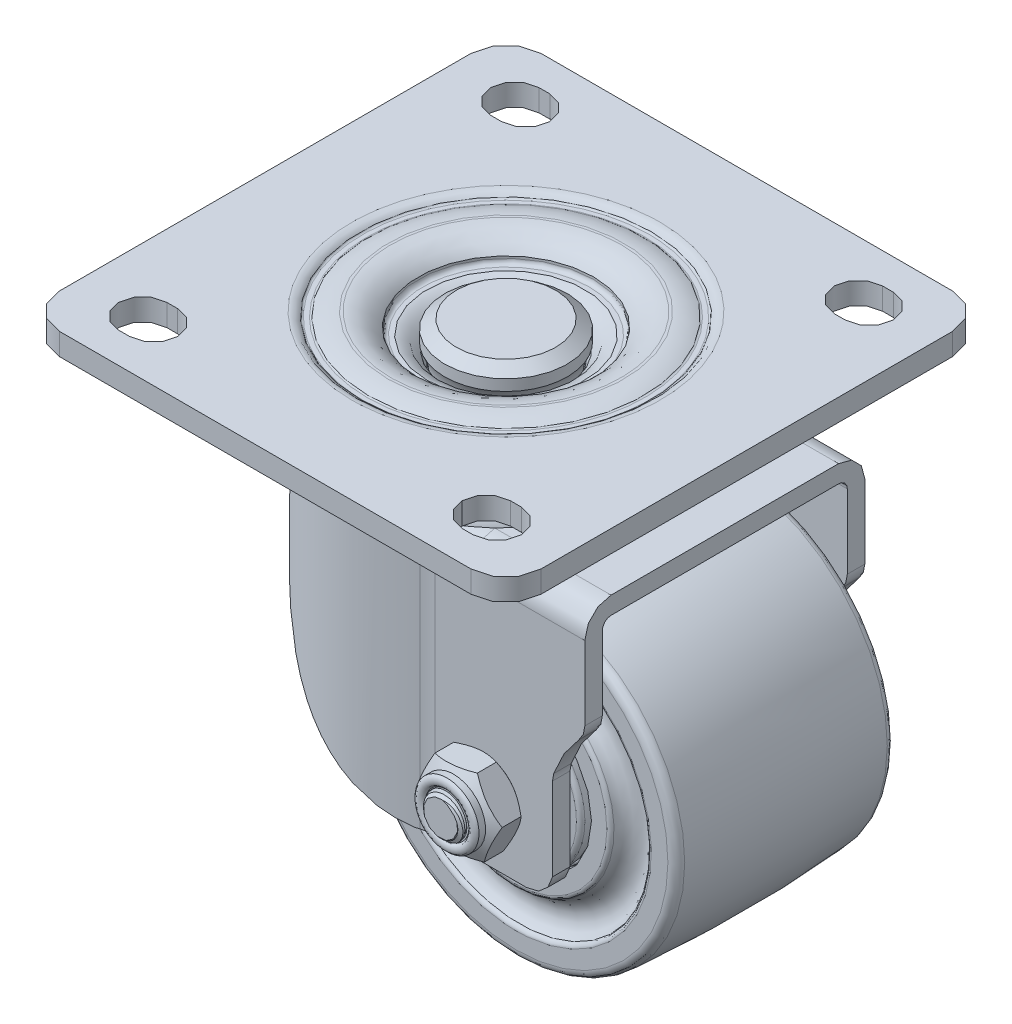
SolidWorks part; units mm, degrees
ref_plane "前视基准面" through (0, 0, 0) normal (0, 0, 1) x (1, 0, 0)
ref_plane "上视基准面" through (0, 0, 0) normal (0, 1, 0) x (1, 0, 0)
ref_plane "右视基准面" through (0, 0, 0) normal (1, 0, 0) x (0, 0, -1)
imported_body "6202轴承_默认-1-solid1"
imported_body "6202轴承_默认-1-solid2"
imported_body "6202轴承_默认-1-solid3"
imported_body "6202轴承_默认-1-solid4"
imported_body "6202轴承_默认-1-solid5"
imported_body "6202轴承_默认-1-solid6"
imported_body "6202轴承_默认-1-solid7"
imported_body "6202轴承_默认-1-solid8"
imported_body "6202轴承_默认-1-solid9"
imported_body "6202轴承_默认-1-solid10"
imported_body "低重心垫片ф16.5×ф25×2.5 _默认-1-solid1"
imported_body "10×74螺杆_默认-1-solid1"
imported_body "低重心上波碗_默认-1-solid1"
imported_body "低重心上波碗_默认-1-solid2"
imported_body "低重心上波碗_默认-1-solid3"
imported_body "低重心上波碗_默认-1-solid4"
imported_body "低重心上波碗_默认-1-solid5"
imported_body "低重心上波碗_默认-1-solid6"
imported_body "低重心上波碗_默认-1-solid7"
imported_body "低重心上波碗_默认-1-solid8"
imported_body "低重心上波碗_默认-1-solid9"
imported_body "低重心上波碗_默认-1-solid10"
imported_body "低重心上波碗_默认-1-solid11"
imported_body "低重心上波碗_默认-1-solid12"
imported_body "低重心上波碗_默认-1-solid13"
imported_body "低重心上波碗_默认-1-solid14"
imported_body "低重心上波碗_默认-1-solid15"
imported_body "低重心上波碗_默认-1-solid16"
imported_body "低重心上波碗_默认-1-solid17"
imported_body "低重心上波碗_默认-1-solid18"
imported_body "低重心上波碗_默认-1-solid19"
imported_body "低重心上波碗_默认-1-solid20"
imported_body "低重心上波碗_默认-1-solid21"
imported_body "盖仔_默认-1-solid1"
imported_body "盖仔_默认-2-solid1"
imported_body "14.85×2.4×55中管_默认-1-solid1"
imported_body "低重心防尘圈_默认-1-solid1"
imported_body "6202轴承_默认-2-solid1"
imported_body "6202轴承_默认-2-solid2"
imported_body "6202轴承_默认-2-solid3"
imported_body "6202轴承_默认-2-solid4"
imported_body "6202轴承_默认-2-solid5"
imported_body "6202轴承_默认-2-solid6"
imported_body "6202轴承_默认-2-solid7"
imported_body "6202轴承_默认-2-solid8"
imported_body "6202轴承_默认-2-solid9"
imported_body "6202轴承_默认-2-solid10"
imported_body "M10螺母_默认-1-solid1"
imported_body "低重心下波碗_默认-1-solid1"
imported_body "低重心下波碗_默认-1-solid2"
imported_body "低重心下波碗_默认-1-solid3"
imported_body "低重心下波碗_默认-1-solid4"
imported_body "低重心下波碗_默认-1-solid5"
imported_body "低重心下波碗_默认-1-solid6"
imported_body "低重心下波碗_默认-1-solid7"
imported_body "低重心下波碗_默认-1-solid8"
imported_body "低重心下波碗_默认-1-solid9"
imported_body "低重心下波碗_默认-1-solid10"
imported_body "低重心下波碗_默认-1-solid11"
imported_body "低重心下波碗_默认-1-solid12"
imported_body "低重心下波碗_默认-1-solid13"
imported_body "低重心下波碗_默认-1-solid14"
imported_body "低重心下波碗_默认-1-solid15"
imported_body "低重心下波碗_默认-1-solid16"
imported_body "低重心下波碗_默认-1-solid17"
imported_body "低重心下波碗_默认-1-solid18"
imported_body "低重心下波碗_默认-1-solid19"
imported_body "低重心下波碗_默认-1-solid20"
imported_body "低重心下波碗_默认-1-solid21"
imported_body "低重心下波碗_默认-1-solid22"
imported_body "低重心3寸活动壳_默认-1-solid1"
imported_body "低重心平头钉16×22 _默认-1-solid1"
imported_body "低重心底板(110×110)_默认-1-solid1"
imported_body "75  50PU轮_默认-1-solid1"
sketch "草图1" plane through (-0.0164, 0, -32.003) normal (-0.0005, 0, -1) x (-1, 0, 0.0005)
  line L1 (-35.0133, -47.4351) -> (-11.5917, -47.4351)
  line L2 (-35.0133, -47.4351) -> (-35.0133, -56.4434)
  line L3 (-35.0133, -56.4434) -> (-11.5917, -56.4434)
  line L4 (-11.5917, -47.4351) -> (-11.5917, -56.4434)
extrude "凸台-拉伸1" add sketch "草图1" against normal blind 1
sketch "草图2" plane through (0.0164, 0, 31.997) normal (0.0005, 0, 1) x (1, 0, -0.0005)
  line L1 (15.012, -42.7808) -> (36.4818, -42.7808)
  line L2 (15.012, -42.7808) -> (15.012, -56.4434)
  line L3 (15.012, -56.4434) -> (36.4818, -56.4434)
  line L4 (36.4818, -42.7808) -> (36.4818, -56.4434)
extrude "凸台-拉伸2" add sketch "草图2" against normal blind 1
sketch "草图3" plane through (0.0127, 0, 24.697) normal (0.0005, 0, 1) x (1, 0, -0.0005)
  circle A0 centre (21.2077, -72.2206) radius 34.6484
  circle A1 centre (21.2077, -72.2206) radius 30.8778
extrude "切除-拉伸1" cut sketch "草图3" along normal up to surface (0.5 mm away)
